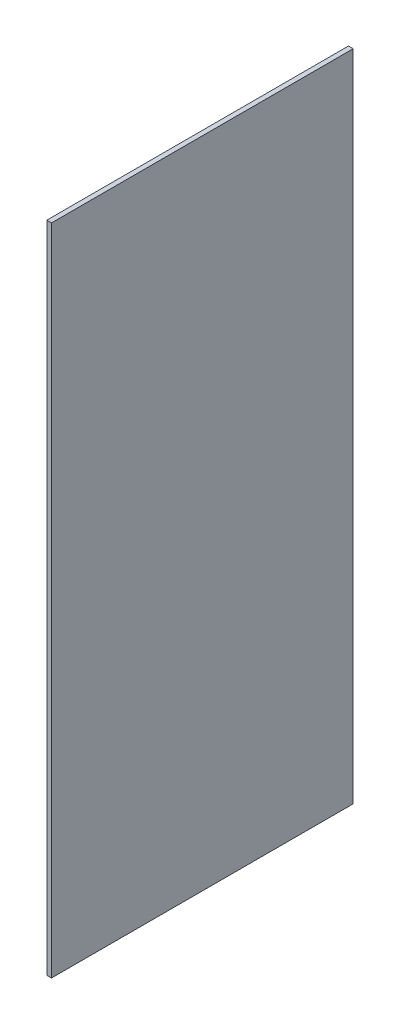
SolidWorks part; units mm, degrees
ref_plane "Front Plane" through (0, 0, 0) normal (1, 0, 0) x (0, 1, 0)
ref_plane "Top Plane" through (0, 0, 0) normal (0, 0, 1) x (0, 1, 0)
ref_plane "Right Plane" through (0, 0, 0) normal (0, 1, 0) x (-1, 0, 0)
sketch "Sketch1" plane through (0, 0, 0) normal (0, 1, 0) x (-1, 0, 0)
  line L1 (-4.7625, 304.8) -> (4.7625, 304.8)
  line L2 (-4.7625, 304.8) -> (-4.7625, -304.8)
  line L3 (-4.7625, -304.8) -> (4.7625, -304.8)
  line L4 (4.7625, 304.8) -> (4.7625, -304.8)
  line L5 (-4.7625, 304.8) -> (4.7625, -304.8) construction
  line L6 (-4.7625, -304.8) -> (4.7625, 304.8) construction
  point P0 (0, 0)
  dimension "D1" = 609.6
  dimension "D2" = 9.525
extrude "Boss-Extrude1" add sketch "Sketch1" along normal blind 1321.4877
